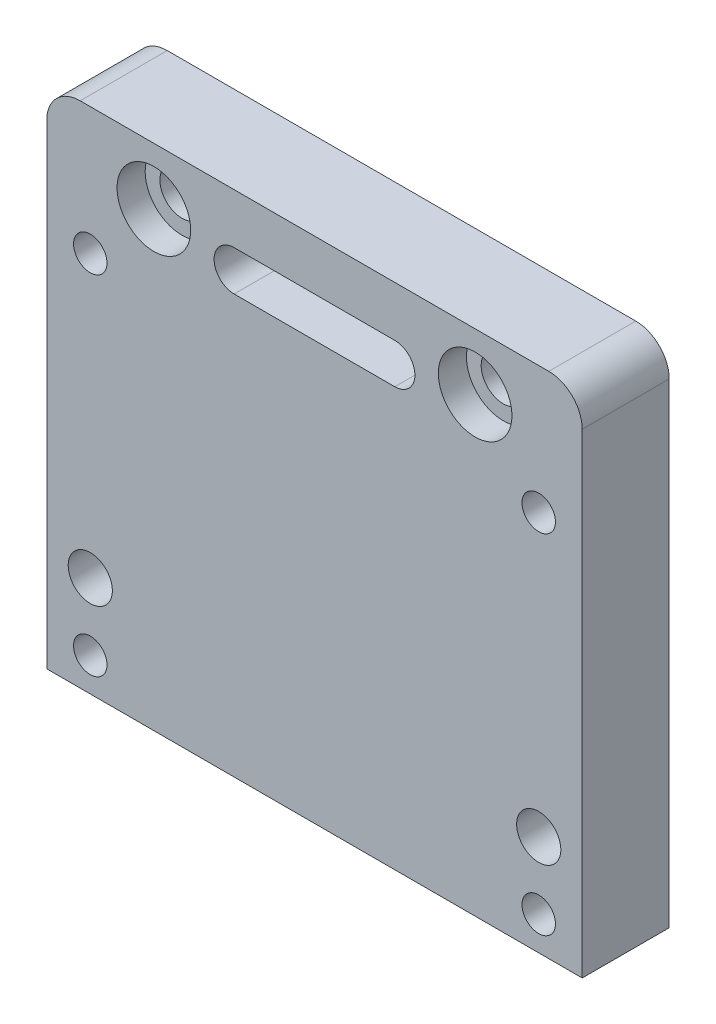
SolidWorks part; units mm, degrees
ref_plane "Ebene vorne" through (0, 0, 0) normal (0, 0, 1) x (1, 0, 0)
ref_plane "Ebene oben" through (0, 0, 0) normal (0, 1, 0) x (1, 0, 0)
ref_plane "Ebene rechts" through (0, 0, 0) normal (1, 0, 0) x (0, 0, -1)
sketch "Skizze1" plane through (0, 0, 0) normal (0, 0, 1) x (1, 0, 0)
  line L1 (-40, 0) -> (40, 0)
  line L2 (-40, 0) -> (-40, 76)
  line L3 (-40, 76) -> (40, 76)
  line L4 (40, 0) -> (40, 76)
  point P4 (0, 0)
  dimension "D1" = 76
  dimension "D2" = 80
extrude "Linear austragen1" add sketch "Skizze1" along normal blind 13
fillet "Verrundung1" radius 5 2 edges at (40, 76, 6.5) (-40, 76, 6.5)
hole_wizard "Stirnsenkung für M8 Zylinderschraube mit Innensechskant1" positions "Skizze3" profile "Skizze2" counterbore size "M8" standard "DIN"
sketch "Skizze3" plane through (0, 0, 13) normal (0, 0, 1) x (1, 0, 0)
  line L0 (0, -6.281) -> (0, 83.4035) construction
  line L2 (-46.944, 38) -> (47.0983, 38) construction
  line L4 (35, 76) -> (-35, 76) construction
  line L5 (-40, 0) -> (40, 0) construction
  point P0 (-18.5, 54.5)
  point P3 (-18.5, 5.5)
  point P19 (18.5, 5.5)
  point P20 (18.5, 54.5)
  dimension "D1" = 18.5
  dimension "D2" = 49
  dimension "D3" = 5.5
sketch "Skizze2" plane through (-18.5, 54.5, 13) normal (1, 0, 0) x (0, -1, 0)
  line L0 (0, 0) -> (0, 13)
  line L1 (0, 13) -> (3.25, 13)
  line L3 (3.25, 13) -> (3.25, 4.7)
  line L4 (3.25, 4.7) -> (5.6, 4.7)
  line L5 (5.6, 4.7) -> (5.6, 0)
  line L7 (5.6, 0) -> (0, 0)
  line L11 (0, -6.35) -> (0, 107.95) construction
  dimension "Bohrerdurchmesser" = 6.5
  dimension "Bohrungstiefe" = 13
  dimension "Senkdurchmesser2" = 11.2
  dimension "Senktiefe2" = 4.7
sketch "Skizze4" [suppressed] plane through (0, 0, 8.3) normal (0, 0, 1) x (1, 0, 0)
  line L0 (-24.1, 5.5) -> (-24.1, 0)
  line L1 (-12.9, 5.5) -> (-12.9, 0)
  line L2 (-17.4464, 0) -> (-19.5536, 0) construction
  line L3 (-12.9, 0) -> (-24.1, 0)
  line L4 (-24.1, 5.5) -> (-12.9, 5.5)
  line L5 (0, 83.9153) -> (0, -15.7012) construction
  line L6 (24.1, 5.5) -> (12.9, 5.5)
  line L7 (12.9, 0) -> (24.1, 0)
  line L8 (12.9, 5.5) -> (12.9, 0)
  line L9 (24.1, 5.5) -> (24.1, 0)
  arc A0 (-17.4464, 0) -> (-19.5536, 0) centre (-18.5, 5.5) ccw construction
  dimension "D1" = 6.6536
  dimension "D2" = 4.5464
extrude "Schnitt-Linear austragen1" [suppressed] cut sketch "Skizze4" along normal up to next
hole_wizard "Ø6.0 (6) Durchmesser Bohrung3" positions "Skizze8" profile "Skizze7" hole size "Ø6.0" standard "Ansi Metrisch"
sketch "Skizze8" plane through (0, 0, 13) normal (0, 0, 1) x (1, 0, 0)
  line L0 (-40, 0) -> (40, 0) construction
  line L1 (-40, 71) -> (-40, 0) construction
  point P0 (0, 30)
  dimension "D1" = 30
  dimension "D2" = 40
sketch "Skizze7" plane through (0, 30, 13) normal (1, 0, 0) x (0, -1, 0)
  line L0 (0, 0) -> (0, 13)
  line L1 (0, 13) -> (17.5, 13)
  line L2 (17.5, 13) -> (17.5, 0)
  line L5 (17.5, 0) -> (0, 0)
  line L11 (0, -6.35) -> (0, 107.95) construction
  dimension "Bohrerdurchmesser" = 35
  dimension "Bohrungstiefe" = 13
hole_wizard "Stirnsenkung für M6 Zylinderschraube mit Innensechskant1" positions "Skizze10" profile "Skizze9" counterbore size "M6" standard "DIN"
sketch "Skizze10" plane through (30.2877, -5.9409, 0) normal (0, 0, 1) x (1, 0, 0)
  line L0 (-30.2877, 5.9409) -> (-30.2877, 81.9409) construction
  line L1 (4.7123, 81.9409) -> (-65.2877, 81.9409) construction
  line L3 (-70.2877, 5.9409) -> (9.7123, 5.9409) construction
  point P0 (-54.2877, 73.4409)
  point P11 (-6.2877, 73.4409)
  point P12 (-63.7877, 20.9409)
  point P15 (3.2123, 20.9409)
  dimension "D1" = 24
  dimension "D2" = 67.5
  dimension "D3" = 15
  dimension "D4" = 33.5
sketch "Skizze9" plane through (-24, 67.5, 0) normal (1, 0, 0) x (0, 1, 0)
  line L0 (0, 0) -> (0, 13)
  line L1 (0, 13) -> (3.3, 13)
  line L3 (3.3, 13) -> (3.3, 4.2)
  line L4 (3.3, 4.2) -> (5.5, 4.2)
  line L5 (5.5, 4.2) -> (5.5, 0)
  line L7 (5.5, 0) -> (0, 0)
  line L11 (0, -6.35) -> (0, 107.95) construction
  dimension "Bohrerdurchmesser" = 6.6
  dimension "Bohrungstiefe" = 13
  dimension "Senkdurchmesser2" = 11
  dimension "Senktiefe2" = 4.2
sketch "Skizze12" plane through (0, 0, 13) normal (0, 0, -1) x (-1, 0, 0)
  line L0 (0, 0) -> (0, 76) construction
  line L1 (40, 0) -> (-40, 0) construction
  line L2 (-35, 76) -> (35, 76) construction
  circle A0 centre (24, 67.5) radius 5.5
  circle A1 centre (-24, 67.5) radius 5.5
  dimension "D1" = 11
extrude "Schnitt-Linear austragen3" cut sketch "Skizze12" along normal blind 4.2
sketch "Skizze13" plane through (0, 0, 13) normal (0, 0, 1) x (1, 0, 0)
  line L0 (-12, 65.5) -> (12, 65.5) construction
  line L1 (0, 0) -> (0, 76) construction
  line L2 (-40, 0) -> (40, 0) construction
  line L3 (35, 76) -> (-35, 76) construction
  line L4 (-12, 62.5) -> (12, 62.5)
  line L5 (-12, 68.5) -> (12, 68.5)
  arc A0 (-12, 62.5) -> (-12, 68.5) centre (-12, 65.5) cw
  arc A1 (12, 62.5) -> (12, 68.5) centre (12, 65.5) ccw
  point P8 (0, 65.5)
  dimension "D3" = 24
  dimension "D4" = 65.5
  dimension "D1" = 3
  dimension "D2" = 3
extrude "Schnitt-Linear austragen4" cut sketch "Skizze13" against normal through all
hole_wizard "M6 Gewindebohrung1" positions "Skizze15" profile "Skizze14" tap size "M6" standard "DIN"
sketch "Skizze15" plane through (0, 0, 13) normal (0, 0, 1) x (1, 0, 0)
  line L1 (0, 0) -> (0, 76) construction
  line L2 (-40, 0) -> (40, 0) construction
  line L3 (35, 76) -> (-35, 76) construction
  line L5 (-40, 0) -> (40, 0) construction
  point P0 (-33.5, 57)
  point P3 (-33.5, 5)
  point P19 (33.5, 5)
  point P20 (33.5, 57)
  dimension "D1" = 33.5
  dimension "D2" = 57
  dimension "D3" = 5
sketch "Skizze14" plane through (-33.5, 57, 13) normal (1, 0, 0) x (0, -1, 0)
  line L0 (0, 0) -> (0, 13)
  line L1 (0, 13) -> (2.5, 13)
  line L2 (2.5, 13) -> (2.5, 0)
  line L5 (2.5, 0) -> (0, 0)
  line L11 (0, -6.35) -> (0, 107.95) construction
  dimension "Bohrerdurchmesser" = 5
  dimension "Bohrungstiefe" = 13
hole_wizard "Ø4.0 (4) Durchmesser Bohrung1" positions "Skizze17" profile "Skizze16" hole size "Ø4.0" standard "Ansi Metrisch"
sketch "Skizze17" plane through (0, 0, 13) normal (0, 0, 1) x (1, 0, 0)
  line L1 (0, 0) -> (0, 76) construction
  line L2 (-40, 0) -> (40, 0) construction
  line L3 (35, 76) -> (-35, 76) construction
  line L4 (-40, 0) -> (40, 0) construction
  point P13 (33.5, 34)
  dimension "D1" = 34
  dimension "D2" = 33.5
sketch "Skizze16" plane through (33.5, 34, 13) normal (1, 0, 0) x (0, -1, 0)
  line L0 (0, 0) -> (0, 14.2017)
  line L1 (0, 14.2017) -> (2, 13)
  line L2 (2, 13) -> (2, 0)
  line L5 (2, 0) -> (0, 0)
  line L10 (0, 14.2017) -> (-2, 13) construction
  line L11 (0, -6.35) -> (0, 107.95) construction
  dimension "Bohrerdurchmesser" = 4
  dimension "Bohrungstiefe" = 13
  dimension "Spitzenwinkel" = 118
